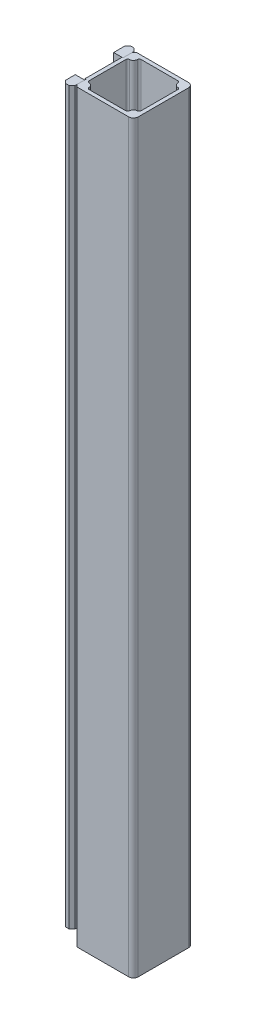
SolidWorks part; units mm, degrees
ref_plane "Ebene vorne" through (0, 0, 0) normal (0, 0, 1) x (1, 0, 0)
ref_plane "Ebene oben" through (0, 0, 0) normal (0, 1, 0) x (1, 0, 0)
ref_plane "Ebene rechts" through (0, 0, 0) normal (1, 0, 0) x (0, 0, -1)
sketch "MasterSeite" plane through (0, 0, 0) normal (1, 0, 0) x (0, 0, -1)
  line L0 (0, 1560) -> (0, 0) construction
  line L1 (-62.5, 1560) -> (62.5, 1560)
  line L2 (-62.5, 1560) -> (-62.5, 0)
  line L3 (-62.5, 0) -> (62.5, 0)
  line L4 (62.5, 1560) -> (62.5, 0)
  line L5 (-68.1, 1559.99) -> (68.1, 1559.99)
  line L6 (-68.1, 1559.99) -> (-68.1, 30)
  line L7 (-68.1, 30) -> (68.1, 30)
  line L8 (68.1, 1559.99) -> (68.1, 30)
  point P10 (0, 30)
  dimension "D1" = 125
  dimension "ModZBeamLtot__" = 1560
  dimension "D2" = 136.2
  dimension "D3" = 0.01
  dimension "D4" = 30
ref_plane "StartSchienen" through (0, 1559.99, 0) normal (0, 1, 0) x (-1, 0, 0)
sketch "Sketch2" plane through (0, 0, 0) normal (0, 1, 0) x (1, 0, 0)
  line L0 (0, -62.5) -> (0, 62.5) construction
  line L1 (-62.5, 0) -> (62.5, 0) construction
  line L2 (-62.5, -38.5) -> (-60.5, -38.5)
  line L3 (-62.5, 38.5) -> (-60.5, 38.5)
  line L4 (-60.5, -38.5) -> (-60.5, -58)
  line L5 (-60.5, -58) -> (-56, -62.5)
  line L6 (-60.5, 58) -> (-56, 62.5)
  line L8 (-60.5, 38.5) -> (-60.5, 58)
  line L11 (-56, -62.5) -> (52.5, -62.5)
  line L12 (-56, 62.5) -> (52.5, 62.5)
  line L15 (62.5, -52.5) -> (62.5, 52.5)
  line L16 (-62.5, -38.5) -> (-62.5, 38.5)
  arc A0 (52.5, -62.5) -> (62.5, -52.5) centre (52.5, -52.5) ccw
  arc A1 (62.5, 52.5) -> (52.5, 62.5) centre (52.5, 52.5) ccw
  point P3 (-60.5, -62.5)
  point P8 (-60.5, 62.5)
  point P16 (0, 0)
  dimension "D2" = 10
  dimension "D1" = 2
  dimension "D5" = 125
  dimension "D6" = 125
  dimension "D8" = 77
extrude "Extrude2" add sketch "Sketch2" along normal up to vertex (1560 mm away)
sketch "Sketch3" plane through (0, 0, 0) normal (0, 1, 0) x (1, 0, 0)
  line L0 (-62.5, 0) -> (62.5, 0) construction
  line L1 (-62.5, 0) -> (62.5, 0) construction
  line L2 (-54.5, -38.5) -> (-50.5, -38.5) construction
  line L3 (-50.5, -38.5) -> (-50.5, -50.5) construction
  line L4 (-38.5, 54.5) -> (38.5, 54.5)
  line L5 (-38.5, -54.5) -> (38.5, -54.5)
  line L6 (-50.5, -50.5) -> (-38.5, -50.5) construction
  line L7 (-38.5, -50.5) -> (-38.5, -54.5) construction
  line L8 (54.5, 38.5) -> (54.5, -38.5)
  line L9 (-54.5, 38.5) -> (-54.5, -38.5)
  line L10 (-62.5, -38.5) -> (-62.5, 38.5) construction
  line L11 (-56, 62.5) -> (52.5, 62.5) construction
  line L12 (62.5, -52.5) -> (62.5, 52.5) construction
  line L13 (38.5, 54.5) -> (38.5, 50.5) construction
  line L14 (38.5, 50.5) -> (50.5, 50.5) construction
  line L15 (50.5, 50.5) -> (50.5, 38.5) construction
  line L16 (50.5, 38.5) -> (54.5, 38.5) construction
  line L17 (38.5, -54.5) -> (38.5, -50.5) construction
  line L18 (38.5, -50.5) -> (50.5, -50.5) construction
  line L19 (50.5, -50.5) -> (50.5, -38.5) construction
  line L20 (50.5, -38.5) -> (54.5, -38.5) construction
  line L21 (-54.5, 38.5) -> (-50.5, 38.5) construction
  line L22 (-50.5, 38.5) -> (-50.5, 50.5) construction
  line L23 (-50.5, 50.5) -> (-38.5, 50.5) construction
  line L24 (-38.5, 50.5) -> (-38.5, 54.5) construction
  arc A0 (-54.5, -38.5) -> (-50.5, -42.5) centre (-50.5, -38.5) ccw
  arc A1 (-38.5, -54.5) -> (-42.5, -50.5) centre (-38.5, -50.5) cw
  arc A2 (-54.5, 38.5) -> (-50.5, 42.5) centre (-50.5, 38.5) cw
  arc A3 (-38.5, 54.5) -> (-42.5, 50.5) centre (-38.5, 50.5) ccw
  arc A4 (38.5, 54.5) -> (42.5, 50.5) centre (38.5, 50.5) cw
  arc A5 (54.5, -38.5) -> (50.5, -42.5) centre (50.5, -38.5) cw
  arc A6 (38.5, -54.5) -> (42.5, -50.5) centre (38.5, -50.5) ccw
  arc A7 (54.5, 38.5) -> (50.5, 42.5) centre (50.5, 38.5) ccw
  arc A8 (-50.5, -42.5) -> (-42.5, -50.5) centre (-50.5, -50.5) cw
  arc A9 (42.5, -50.5) -> (50.5, -42.5) centre (50.5, -50.5) cw
  arc A10 (42.5, 50.5) -> (50.5, 42.5) centre (50.5, 50.5) ccw
  arc A11 (-50.5, 42.5) -> (-42.5, 50.5) centre (-50.5, 50.5) ccw
  dimension "D1" = 4
  dimension "D2" = 8
  dimension "D3" = 8
  dimension "D4" = 8
  dimension "D5" = 8
  dimension "D6" = 77
extrude "Cut-Extrude2" cut sketch "Sketch3" along normal through all
sketch "Sketch4" plane through (0, 1559.99, 0) normal (0, 1, 0) x (1, 0, 0)
  line L0 (0, 0) -> (-95.7937, 0) construction
  line L1 (-70.25, -68) -> (-70.25, 72) construction
  line L2 (-60.5, -41.87) -> (-60.5, -62)
  line L3 (-80, -41.87) -> (-80, -62)
  line L4 (-60.5, -62) -> (-66.5, -68)
  line L5 (-80, -62) -> (-74, -68)
  line L6 (-66.5, -68) -> (-74, -68)
  line L7 (-60.5, -41.87) -> (-80, -41.87)
  line L8 (-60.5, 38.5) -> (-80, 38.5)
  line L9 (-66.5, 68) -> (-74, 68)
  line L10 (-80, 62) -> (-74, 68)
  line L11 (-60.5, 62) -> (-66.5, 68)
  line L12 (-80, 38.5) -> (-80, 62)
  line L13 (-60.5, 38.5) -> (-60.5, 62)
  line L14 (-60.5, -38.5) -> (-60.5, -58) construction
  line L17 (-62.5, 38.5) -> (-60.5, 38.5) construction
  line L18 (-60.5, 38.5) -> (-60.5, 58) construction
  dimension "D1" = 26.13
  dimension "D2" = 19.5
  dimension "D3" = 90
  dimension "D4" = 20.13
  dimension "D5" = 41.87
  dimension "D6" = 29.5
  dimension "D7" = 90
extrude "Extrude3" add sketch "Sketch4" against normal up to vertex (1499.98 mm away) contours L2 L7 L3 L5 L6 L4 | L8 L13 L11 L9 L10 L12
hole_wizard "M6x1.0 Gewindekernloch1" positions "Sketch6" profile "Sketch5" tap size "M8x1.25" standard "DIN"
sketch "Sketch6" plane through (0, 0, 0) normal (0, -1, 0) x (1, 0, 0)
  line L1 (52.5, 52.5) -> (52.5, -52.5) construction
  line L2 (52.5, 52.5) -> (-52.5, 52.5) construction
  line L3 (-52.5, 52.5) -> (-52.5, -52.5) construction
  line L4 (52.5, -52.5) -> (-52.5, -52.5) construction
  line L5 (52.5, 0) -> (-52.5, 0) construction
  line L6 (0, 52.5) -> (0, -52.5) construction
  line L8 (-62.5, 0) -> (62.5, 0) construction
  line L9 (0, 62.5) -> (0, -62.5) construction
  point P0 (52.5, -52.5)
  point P1 (52.5, 52.5)
  point P3 (-52.5, 52.5)
  point P5 (-52.5, -52.5)
  dimension "D1" = 105
  dimension "D2" = 105
sketch "Sketch5" plane through (52.5, 0, -52.5) normal (1, 0, 0) x (0, 0, -1)
  line L0 (0, 0) -> (0, 26.963)
  line L1 (0, 26.963) -> (3.4, 25)
  line L2 (3.4, 25) -> (3.4, 0)
  line L5 (3.4, 0) -> (0, 0)
  line L10 (0, 26.963) -> (-3.4, 25) construction
  line L11 (0, -6.35) -> (0, 107.95) construction
  dimension "Bohrerdurchmesser" = 6.8
  dimension "Bohrungstiefe" = 25
  dimension "Spitzenwinkel" = 120
sketch "Skizze4" plane through (0, 0, 0) normal (0, 0, 1) x (1, 0, 0)
  line L0 (-105, 1559.999) -> (-105, 1519.999) construction
  line L1 (-120, 1559.999) -> (-80, 1559.999)
  line L2 (-120, 1559.999) -> (-120, 1519.999)
  line L3 (-120, 1519.999) -> (-80, 1519.999)
  line L4 (-80, 1559.999) -> (-80, 1519.999)
  line L5 (-56, 1560) -> (52.5, 1560) construction
  line L6 (-80, 30) -> (-80, 1559.99) construction
  dimension "D1" = 25
  dimension "D2" = 40
  dimension "D3" = 40
  dimension "D4" = 0.001
sketch "Skizze5" plane through (0, 0, 0) normal (0, 0, 1) x (1, 0, 0)
  line L0 (-105, 1519.999) -> (-105, 1375.2663) construction
  line L1 (-105, 1559.999) -> (-105, 1519.999) construction
  line L2 (-120, 1519.999) -> (-80, 1519.999) construction
  line L3 (-122.5, 1519.999) -> (-105, 1519.999)
  line L4 (-122.5, 1519.999) -> (-122.5, 1434.999)
  line L5 (-122.5, 1434.999) -> (-105, 1434.999)
  line L6 (-105, 1434.999) -> (-105, 1519.999)
  dimension "D1" = 85
  dimension "D2" = 35
sketch "Skizze6" plane through (0, 0, -62.5) normal (0, 0, -1) x (-1, 0, 0)
  line L0 (-52.5, 1560) -> (56, 1560) construction
  line L1 (7.5, 1472.5) -> (43.5, 1472.5)
  line L2 (7.5, 1472.5) -> (7.5, 1392.5)
  line L3 (7.5, 1392.5) -> (43.5, 1392.5)
  line L4 (43.5, 1472.5) -> (43.5, 1392.5)
  line L5 (-52.5, 0) -> (56, 0) construction
  line L6 (7.5, 278.5) -> (43.5, 278.5)
  line L7 (7.5, 278.5) -> (7.5, 198.5)
  line L8 (7.5, 198.5) -> (43.5, 198.5)
  line L9 (43.5, 278.5) -> (43.5, 198.5)
  dimension "D1" = 19
  dimension "D2" = 36
  dimension "D3" = 87.5
  dimension "D4" = 80
  dimension "D5" = 198.5
extrude "Aufsatz-Linear austragen1" add sketch "Skizze6" along normal blind 48 separate body
sketch "Skizze7" plane through (0, 1392.5, 0) normal (0, -1, 0) x (1, 0, 0)
  line L0 (-7.5, -110.5) -> (-43.5, -110.5) construction
  line L1 (-25.5, -110.5) -> (-25.5, -90.5) construction
  circle A0 centre (-25.5, -90.5) radius 14
  dimension "D1" = 20
  dimension "D2" = 28
extrude "Aufsatz-Linear austragen2" add sketch "Skizze7" along normal blind 114 separate body
hole_wizard "Ø5.0 (5) Durchmesser Bohrung1" positions "Skizze9" profile "Skizze8" hole size "Ø5.0" standard "DIN"
sketch "Skizze9" plane through (0, 0, 0) normal (0, -1, 0) x (1, 0, 0)
  circle A0 centre (-52.5, 52.5) radius 3.4 construction
  circle A1 centre (52.5, -52.5) radius 3.4 construction
  circle A2 centre (52.5, -52.5) radius 3.4 construction
  circle A3 centre (-52.5, 52.5) radius 3.4 construction
  point P0 (-42.5, 58.5)
  point P2 (42.5, -58.5)
  dimension "D1" = 6
  dimension "D2" = 6
  dimension "D3" = 10
  dimension "D4" = 10
sketch "Skizze8" plane through (-42.5, 0, 58.5) normal (1, 0, 0) x (0, 0, -1)
  line L0 (0, 0) -> (0, 13.5022)
  line L1 (0, 13.5022) -> (2.5, 12)
  line L2 (2.5, 12) -> (2.5, 0)
  line L5 (2.5, 0) -> (0, 0)
  line L10 (0, 13.5022) -> (-2.5, 12) construction
  line L11 (0, -6.35) -> (0, 107.95) construction
  dimension "Bohrerdurchmesser" = 5
  dimension "Bohrungstiefe" = 12
  dimension "Spitzenwinkel" = 118
